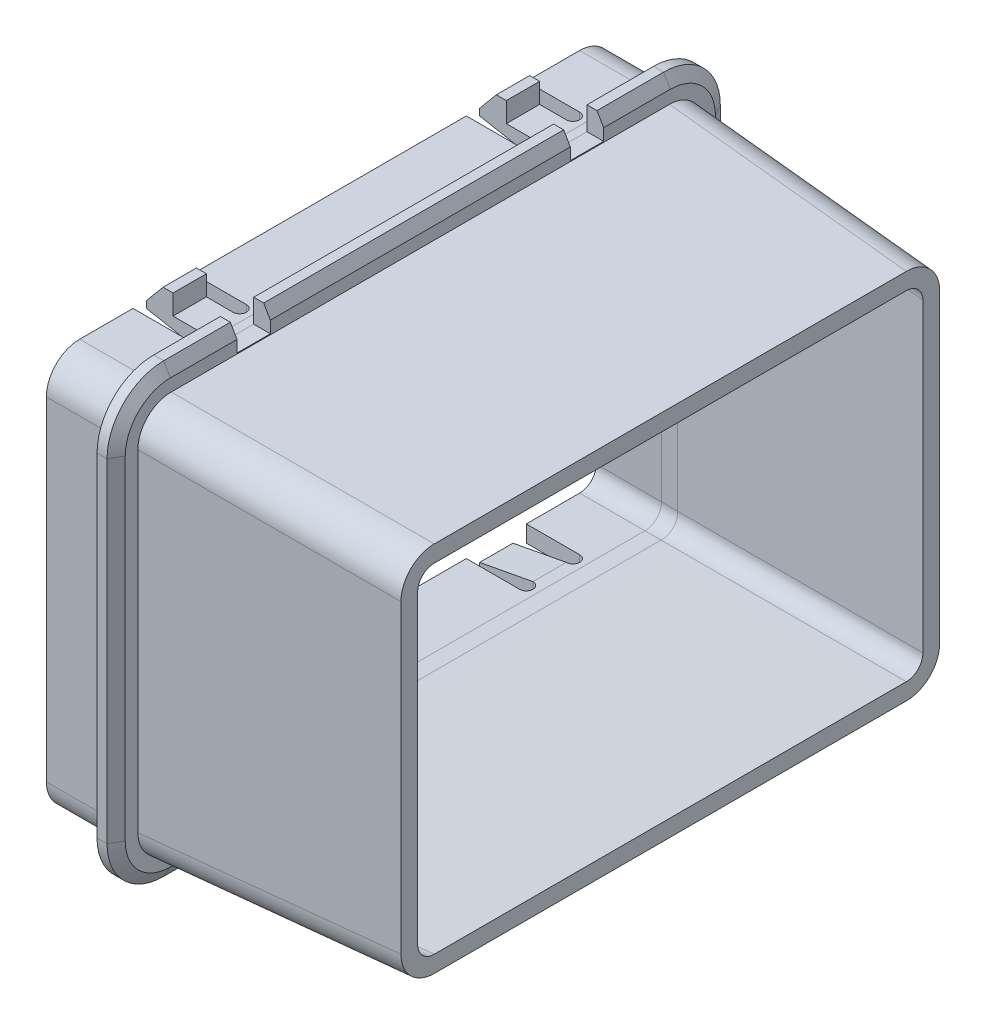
SolidWorks part; units mm, degrees
ref_plane "Front" through (0, 0, 0) normal (0, 0, 1) x (1, 0, 0)
ref_plane "Top" through (0, 0, 0) normal (0, 1, 0) x (1, 0, 0)
ref_plane "Right" through (0, 0, 0) normal (1, 0, 0) x (0, 0, -1)
sketch "Sketch1" plane through (0, 0, 0) normal (1, 0, 0) x (0, 0, -1)
  line L1 (42.5, 30) -> (-42.5, 30)
  line L2 (42.5, 30) -> (42.5, -30)
  line L3 (42.5, -30) -> (-42.5, -30)
  line L4 (-42.5, 30) -> (-42.5, -30)
  line L5 (42.5, 30) -> (-42.5, -30) construction
  line L6 (42.5, -30) -> (-42.5, 30) construction
  point P0 (0, 0)
  dimension "D1" = 85
  dimension "D2" = 60
extrude "Boss-Extrude1" add sketch "Sketch1" along normal blind 40 draft 3
sketch "Sketch2" plane through (0, 0, 0) normal (1, 0, 0) x (0, 0, -1)
  line L4 (-42.5, 30) -> (-42.5, -30)
  line L5 (42.5, 30) -> (-42.5, 30)
  line L6 (42.5, -30) -> (42.5, 30)
  line L7 (-42.5, -30) -> (42.5, -30)
  line L8 (-42.5, 30) -> (-42.5, -30)
  line L9 (42.5, 30) -> (-42.5, 30)
  line L10 (42.5, -30) -> (42.5, 30)
  line L11 (-42.5, -30) -> (42.5, -30)
  dimension "D1" = 0
extrude "Boss-Extrude2" add sketch "Sketch2" against normal blind 11.1
fillet "Fillet3" radius 50 4 edges at (0, 0, -42.5) (0, -30, 0) (0, 0, 42.5) (0, 30, 0)
fillet "Fillet4" radius 5 12 edges at (-6.2046, 30, -42.5) (-0.0004, 29.9829, -42.4829) (-6.2046, -30, -42.5) (-0.0004, -29.9829, -42.4829) (-6.2046, -30, 42.5) (-0.0004, -29.9829, 42.4829) (-6.2046, 30, 42.5) (-0.0004, 29.9829, 42.4829) (20.6538, 28.9176, -41.4176) (20.6538, -28.9176, -41.4176) (20.6538, -28.9176, 41.4176) (20.6538, 28.9176, 41.4176)
shell "Shell2" thickness 2.5
ref_plane "Plane3" through (0, 0, -25) normal (0, 0, 1) x (1, 0, 0)
sketch "Sketch7" plane through (0, 0, 0) normal (1, 0, 0) x (0, 0, -1)
  line L8 (37.5, 33.5) -> (-37.5, 33.5)
  line L9 (46, -25) -> (46, 25)
  line L10 (-37.5, -33.5) -> (37.5, -33.5)
  line L11 (-46, 25) -> (-46, -25)
  line L12 (37.5, 33.5) -> (-37.5, 33.5)
  line L13 (46, -25) -> (46, 25)
  line L14 (-37.5, -33.5) -> (37.5, -33.5)
  line L15 (-46, 25) -> (-46, -25)
  line L20 (37.5, 29.5) -> (-37.5, 29.5)
  line L21 (42, -25) -> (42, 25)
  line L22 (-37.5, -29.5) -> (37.5, -29.5)
  line L23 (-42, 25) -> (-42, -25)
  line L24 (37.5, 29.5) -> (-37.5, 29.5)
  line L25 (42, -25) -> (42, 25)
  line L26 (-37.5, -29.5) -> (37.5, -29.5)
  line L27 (-42, 25) -> (-42, -25)
  arc A8 (46, 25) -> (37.5, 33.5) centre (37.5, 25) ccw
  arc A9 (37.5, -33.5) -> (46, -25) centre (37.5, -25) ccw
  arc A10 (-46, -25) -> (-37.5, -33.5) centre (-37.5, -25) ccw
  arc A11 (-37.5, 33.5) -> (-46, 25) centre (-37.5, 25) ccw
  arc A12 (46, 25) -> (37.5, 33.5) centre (37.5, 25) ccw
  arc A13 (37.5, -33.5) -> (46, -25) centre (37.5, -25) ccw
  arc A14 (-46, -25) -> (-37.5, -33.5) centre (-37.5, -25) ccw
  arc A15 (-37.5, 33.5) -> (-46, 25) centre (-37.5, 25) ccw
  arc A20 (42, 25) -> (37.5, 29.5) centre (37.5, 25) ccw
  arc A21 (37.5, -29.5) -> (42, -25) centre (37.5, -25) ccw
  arc A22 (-42, -25) -> (-37.5, -29.5) centre (-37.5, -25) ccw
  arc A23 (-37.5, 29.5) -> (-42, 25) centre (-37.5, 25) ccw
  arc A24 (42, 25) -> (37.5, 29.5) centre (37.5, 25) ccw
  arc A25 (37.5, -29.5) -> (42, -25) centre (37.5, -25) ccw
  arc A26 (-42, -25) -> (-37.5, -29.5) centre (-37.5, -25) ccw
  arc A27 (-37.5, 29.5) -> (-42, 25) centre (-37.5, 25) ccw
  dimension "D1" = 3.5
  dimension "D2" = 0.5
extrude "Boss-Extrude6" add sketch "Sketch7" along normal blind 2.5
chamfer "Chamfer2" distance 1 angle 60 8 edges at (2.5, -31.0104, 43.5104) (2.5, -33.5, 0) (2.5, 0, 46) (2.5, -31.0104, -43.5104) (2.5, 31.0104, 43.5104) (2.5, 0, -46) (2.5, 33.5, 0) (2.5, 31.0104, -43.5104)
sketch "Sketch8" plane through (0, 30, 0) normal (0, 1, 0) x (1, 0, 0)
  line L0 (-11.1, 28.5) -> (-3.1, 28.5) construction
  line L1 (-11.1, 29.5) -> (-3.1, 29.5)
  line L2 (-11.1, 27.5) -> (-3.1, 27.5)
  line L3 (-11.1, 37.5) -> (-11.1, -37.5) construction
  line L4 (-6.4174, 25) -> (-18.1788, 25) construction
  line L5 (-28.6, 25) -> (28.6, 25) construction
  line L6 (-11.1, 21.5) -> (-3.1, 21.5) construction
  line L7 (-11.1, 20.5) -> (-3.1, 20.5)
  line L8 (-11.1, 22.5) -> (-3.1, 22.5)
  arc A0 (-11.1, 29.5) -> (-11.1, 27.5) centre (-11.1, 28.5) ccw
  arc A1 (-3.1, 27.5) -> (-3.1, 29.5) centre (-3.1, 28.5) ccw
  arc A2 (-11.1, 20.5) -> (-11.1, 22.5) centre (-11.1, 21.5) cw
  arc A3 (-3.1, 22.5) -> (-3.1, 20.5) centre (-3.1, 21.5) cw
  point P2 (-7.1, 28.5)
  point P15 (-7.1, 21.5)
  dimension "D1" = 8
  dimension "D2" = 2
  dimension "D3" = 5
extrude "Cut-Extrude1" cut sketch "Sketch8" against normal up to next
sketch "Sketch9" plane through (0, 0, -25) normal (0, 0, 1) x (1, 0, 0)
  line L0 (-7.1, 30) -> (-7.1, 33)
  line L1 (-7.1, 33) -> (-8.6, 33)
  line L2 (-8.6, 33) -> (-11.1, 30)
  line L3 (-11.1, 30) -> (-7.1, 30)
  line L4 (-11.1, 30) -> (-3.1, 30) construction
  point P6 (0, 0)
  point P8 (-8.2045, 30)
  dimension "D1" = 3
  dimension "D2" = 1.5
  dimension "D3" = 4
extrude "Boss-Extrude7" add sketch "Sketch9" along normal mid plane 5
sketch "Sketch10" plane through (0, 0, -25) normal (0, 0, 1) x (1, 0, 0)
  line L0 (-3.1, 27.5) -> (-11.1, 29)
  line L1 (-11.1, 29) -> (-11.1, 27.5)
  line L2 (-11.1, 27.5) -> (-3.1, 27.5)
  line L3 (-3.1, 27.5) -> (-11.1, 27.5) construction
  line L4 (-11.1, 27.5) -> (-11.1, 30) construction
  line L5 (-7.1, 30) -> (-3.1, 30) construction
  line L6 (3.5, 30) -> (0, 30)
  line L7 (3.5, 30) -> (3.5, 33.5)
  line L8 (3.5, 33.5) -> (0, 33.5)
  line L9 (0, 30) -> (0, 33.5)
  point P14 (-1.3399, 30.0175)
  point P16 (0, 0)
  point P17 (0, 0)
  point P18 (3.3892, 27)
  dimension "D1" = 1.5
  dimension "D2" = 3.5
extrude "Cut-Extrude2" cut sketch "Sketch10" against normal mid plane 5
mirror "Mirror3" about plane through (0, 0, 0) normal (0, 0, 1) of "Cut-Extrude2", "Boss-Extrude7", "Cut-Extrude1"
mirror "Mirror4" about plane through (0, 0, 0) normal (0, 1, 0) of "Mirror3", "Cut-Extrude1", "Boss-Extrude7", "Cut-Extrude2"
